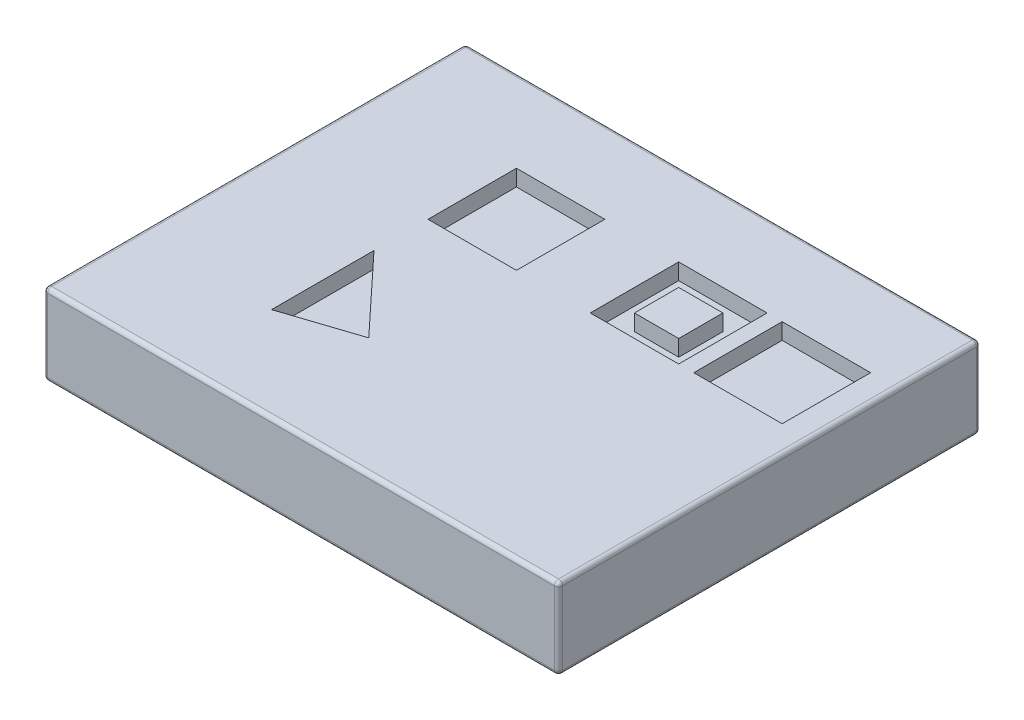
SolidWorks part; units mm, degrees
ref_plane "Piano frontale" through (0, 0, 0) normal (0, 0, 1) x (1, 0, 0)
ref_plane "Piano superiore" through (0, 0, 0) normal (0, 1, 0) x (1, 0, 0)
ref_plane "Piano destro" through (0, 0, 0) normal (1, 0, 0) x (0, 0, -1)
sketch "Schizzo1" plane through (0, 0, 0) normal (0, 1, 0) x (1, 0, 0)
  line L0 (0, 0) -> (63.4654, 0)
  line L1 (63.4654, 0) -> (63.4654, 52.0064)
  line L2 (63.4654, 52.0064) -> (0, 52.0064)
  line L3 (0, 52.0064) -> (0, 0)
  dimension "D1" = 63.4654
extrude "Estrusione-Estrusione1" add sketch "Schizzo1" along normal blind 10
ref_plane "Piano1" through (0, 10, 0) normal (0, 1, 0) x (1, 0, 0)
sketch "Schizzo3" plane through (0, 10, 0) normal (0, 1, 0) x (1, 0, 0)
  line L0 (16.5348, 41.7479) -> (27.4343, 41.7479)
  line L1 (27.4343, 41.7479) -> (27.4343, 30.8484)
  line L2 (27.4343, 30.8484) -> (16.5348, 30.8484)
  line L3 (16.5348, 30.8484) -> (16.5348, 41.7479)
  line L4 (36.5348, 41.7479) -> (47.4343, 41.7479)
  line L5 (47.4343, 41.7479) -> (47.4343, 30.8484)
  line L6 (47.4343, 30.8484) -> (36.5348, 30.8484)
  line L7 (36.5348, 30.8484) -> (36.5348, 41.7479)
  line L8 (16.5348, 11.5625) -> (16.5348, 24.1913)
  line L9 (16.5348, 24.1913) -> (25.5381, 14.5383)
  line L10 (25.5381, 14.5383) -> (16.5348, 11.5625)
  line L11 (16.5348, 24.1913) -> (57.0859, 24.1913) construction
  line L12 (57.0859, 24.1913) -> (25.5381, 14.5383) construction
  line L13 (25.5381, 14.5383) -> (54.7389, 9.6122) construction
  line L14 (54.7389, 9.6122) -> (57.0859, 24.1913) construction
  line L15 (36.5348, 41.7479) -> (47.4343, 30.8484) construction
  line L16 (47.4343, 41.7479) -> (36.5348, 31.3611) construction
  line L17 (49.2891, 30.8484) -> (49.2891, 41.7479)
  line L18 (60.1887, 41.7479) -> (60.1887, 30.8484)
  line L19 (49.2891, 41.7479) -> (60.1887, 41.7479)
  line L20 (60.1887, 30.8484) -> (49.2891, 30.8484)
  line L21 (39.2597, 33.5732) -> (39.2597, 39.023)
  line L22 (39.2597, 39.023) -> (44.7094, 39.023)
  line L23 (44.7094, 39.023) -> (44.7094, 33.5732)
  line L24 (44.7094, 33.5732) -> (39.2597, 33.5732)
  dimension "D1" = 2
  dimension "D2" = 1
extrude "Taglio-Estrusione1" cut sketch "Schizzo3" against normal blind 2
fillet "Raccordo3" radius 0.5 12 edges at (63.4654, 10, -26.0032) (63.4654, 0, -26.0032) (63.4654, 5, -52.0064) (31.7327, 10, -52.0064) (31.7327, 0, -52.0064) (0, 5, -52.0064) (0, 10, -26.0032) (0, 0, -26.0032) (0, 5, 0) (31.7327, 10, 0) (63.4654, 5, 0) (31.7327, 0, 0)
